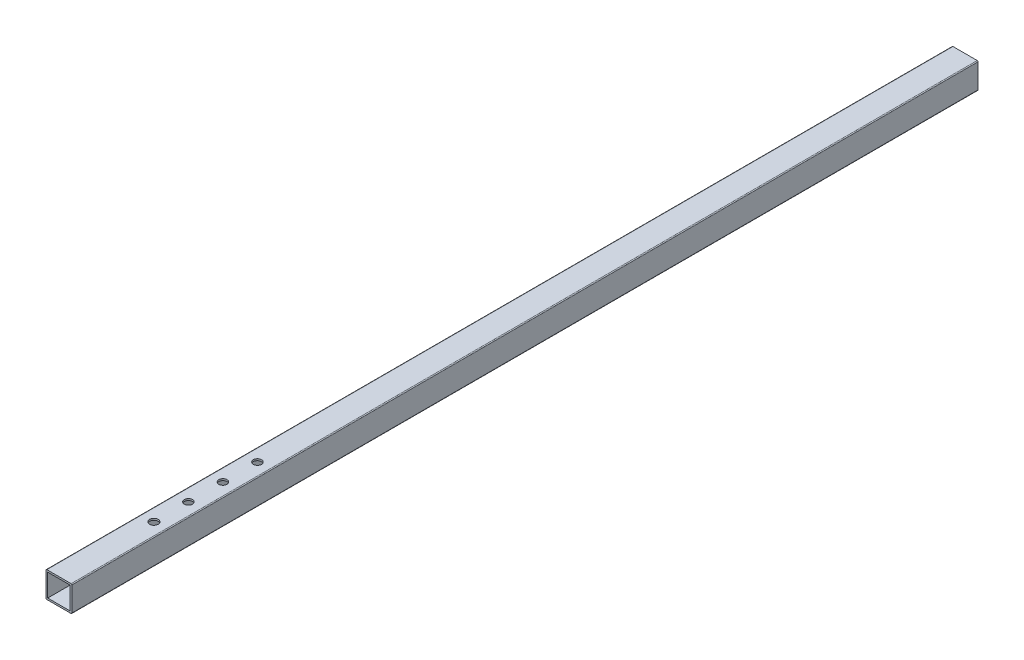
SolidWorks part; units mm, degrees
ref_plane "Plan1" through (0, 0, 0) normal (0, 0, 1) x (1, 0, 0)
ref_plane "Plan2" through (0, 0, 0) normal (0, 1, 0) x (1, 0, 0)
ref_plane "Plan3" through (0, 0, 0) normal (1, 0, 0) x (0, 0, -1)
sketch "Esquisse1" plane through (0, 0, 0) normal (0, 0, 1) x (1, 0, 0)
  line L0 (-14, 15) -> (14, 15)
  line L1 (-15, 14) -> (-15, -14)
  line L2 (14, -15) -> (-14, -15)
  line L3 (15, -14) -> (15, 14)
  line L4 (14, 14) -> (-14, -14) construction
  arc A0 (-14, -15) -> (-15, -14) centre (-14, -14) cw
  arc A1 (-15, 14) -> (-14, 15) centre (-14, 14) cw
  arc A2 (15, 14) -> (14, 15) centre (14, 14) ccw
  arc A3 (15, -14) -> (14, -15) centre (14, -14) cw
  dimension "D1" = 1
  dimension "D2" = 30
extrude "Base-Extru.-Mince" add sketch "Esquisse1" along normal blind 1050 thin
sketch "Esquisse3" plane through (0, -15, 0) normal (0, -1, 0) x (1, 0, 0)
  line L0 (15, 1050) -> (15, 0) construction
  line L1 (14, 1050) -> (-14, 1050) construction
  circle A0 centre (0, 820) radius 4.75
  circle A1 centre (0, 940) radius 5
  dimension "D1" = 9.5
  dimension "D3" = 820
  dimension "D2" = 15
  dimension "D4" = 120
  dimension "D5" = 110
extrude "Enlèv. mat.-Extru.2" cut sketch "Esquisse3" against normal blind 35
sketch "Esquisse4" plane through (0, 15, 0) normal (0, -1, 0) x (1, 0, 0)
  circle A0 centre (0, 860) radius 4.75
  circle A1 centre (0, 900) radius 4.75
  circle A2 centre (0, 940) radius 5 construction
  dimension "D1" = 9.5
  dimension "D2" = 40
  dimension "D3" = 40
extrude "Enlèv. mat.-Extru.3" cut sketch "Esquisse4" along normal blind 10
